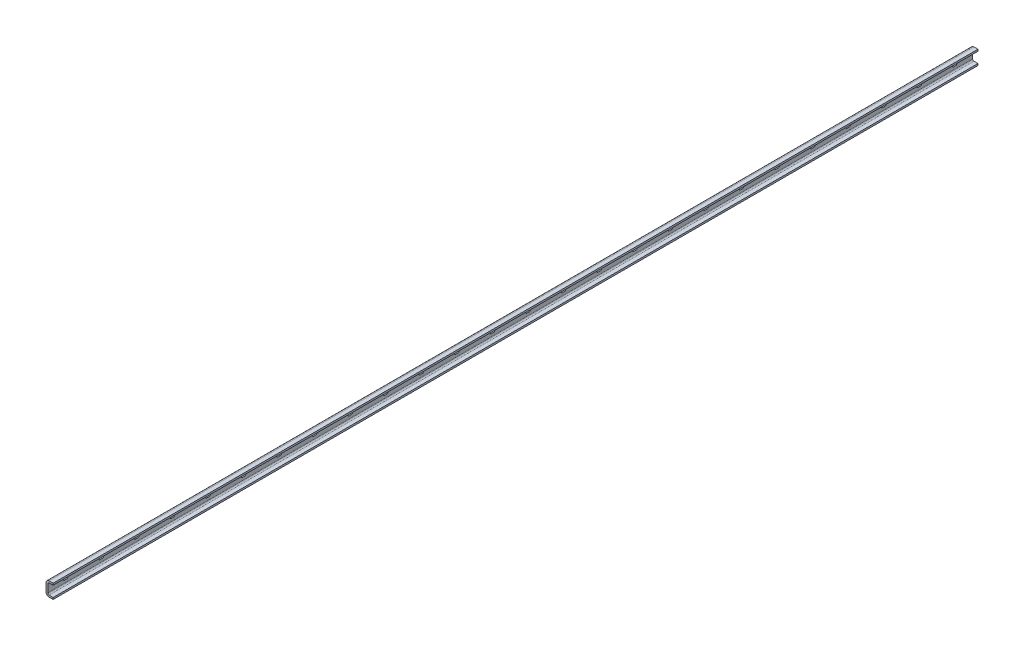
SolidWorks part; units mm, degrees
ref_plane "Front Plane" through (0, 0, 0) normal (0, 0, 1) x (1, 0, 0)
ref_plane "Top Plane" through (0, 0, 0) normal (0, 1, 0) x (1, 0, 0)
ref_plane "Right Plane" through (0, 0, 0) normal (1, 0, 0) x (0, 0, -1)
sketch "Sketch1" plane through (0, 0, 0) normal (0, 0, 1) x (1, 0, 0)
  line L0 (16, 11.9) -> (16, 15.9)
  line L1 (16, 15.9) -> (7, 15.9)
  line L2 (0, 8.9) -> (0, -8.9)
  line L3 (7, -15.9) -> (16, -15.9)
  line L4 (16, -15.9) -> (16, -11.9)
  line L5 (16, -11.9) -> (7, -11.9)
  line L6 (4, -8.9) -> (4, 8.9)
  line L7 (7, 11.9) -> (16, 11.9)
  arc A0 (7, 15.9) -> (0, 8.9) centre (7, 8.9) ccw
  arc A1 (0, -8.9) -> (7, -15.9) centre (7, -8.9) ccw
  arc A2 (7, -11.9) -> (4, -8.9) centre (7, -8.9) cw
  arc A3 (4, 8.9) -> (7, 11.9) centre (7, 8.9) cw
  dimension "D1" = 7
  dimension "D2" = 3
  dimension "D3" = 16
  dimension "D4" = 11.9
  dimension "D5" = 11.9
extrude "Extrude1" add sketch "Sketch1" against normal blind 2080
sketch "Sketch2" plane through (4, 0, 0) normal (1, 0, 0) x (0, 0, -1)
  line L0 (37.5, 0) -> (42.5, 0) construction
  line L1 (37.5, 3) -> (42.5, 3)
  line L2 (37.5, -3) -> (42.5, -3)
  arc A0 (37.5, 3) -> (37.5, -3) centre (37.5, 0) ccw
  arc A1 (42.5, 3) -> (42.5, -3) centre (42.5, 0) cw
  point P7 (40, 0)
  dimension "D1" = 5
  dimension "D2" = 6
  dimension "D3" = 40
extrude "Extrude2" cut sketch "Sketch2" against normal through all
pattern_linear "LPattern1" count 26 spacing 80 along (0, 0, -1) of "Extrude2"
